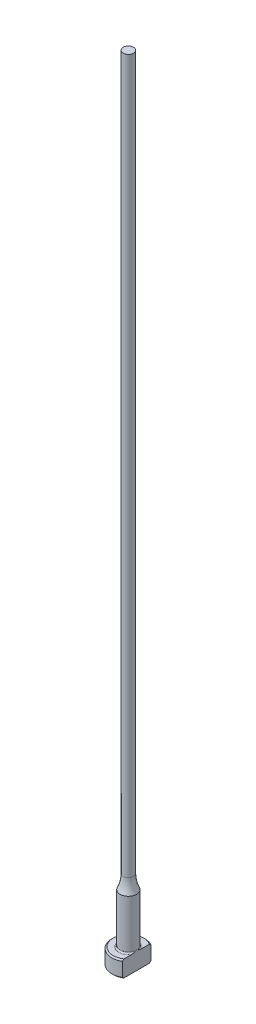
SolidWorks part; units mm, degrees
ref_plane "Front Plane" through (0, 0, 0) normal (0, 0, 1) x (1, 0, 0)
ref_plane "Top Plane" through (0, 0, 0) normal (0, 1, 0) x (1, 0, 0)
ref_plane "Right Plane" through (0, 0, 0) normal (1, 0, 0) x (0, 0, -1)
sketch "Sketch1" plane through (0, 0, 0) normal (0, 0, 1) x (1, 0, 0)
  line L0 (0, 259.9588) -> (0, -15.1925) construction
  line L1 (0, 0) -> (-3.175, 0)
  line L2 (-3.175, 0) -> (-3.175, 3.175)
  line L3 (-3.175, 3.175) -> (-1.5875, 3.175)
  line L4 (-0.9919, 15.3851) -> (-0.9919, 152.4)
  line L5 (-0.9919, 152.4) -> (0, 152.4)
  line L6 (0, 152.4) -> (0, 0)
  line L7 (-1.5875, 3.175) -> (-1.5875, 12.7)
  arc A0 (-1.5875, 12.7) -> (-0.9919, 15.3851) centre (-7.3419, 15.3851) ccw
  point P13 (-1.5875, 0)
  dimension "D1" = 6.35
  dimension "L" = 152.4
  dimension "D2" = 3.175
  dimension "H" = 6.35
  dimension "T" = 3.175
  dimension "D" = 1.9837
  dimension "S" = 12.7
revolve "Revolve1" add sketch "Sketch1" angle 360 about L0
chamfer "Chamfer1" distance 0.254 angle 45 2 edges at (0, 3.175, 3.175) (0, 0, 3.175)
fillet "Fillet1" radius 0.254 1 edges at (0, 3.175, 1.5875)
sketch "Sketch2" plane through (0, 0, 0) normal (0, 1, 0) x (1, 0, 0)
  line L0 (1.5875, -2.7496) -> (1.5875, 2.7496)
  circle A0 centre (0, 0) radius 3.175 construction
  arc A2 (1.5875, -2.7496) -> (1.5875, 2.7496) centre (0, 0) ccw
  circle A3 centre (0, 0) radius 3.175 construction
  circle A4 centre (0, 0) radius 1.5875 construction
extrude "Key Head" cut sketch "Sketch2" along normal up to next
